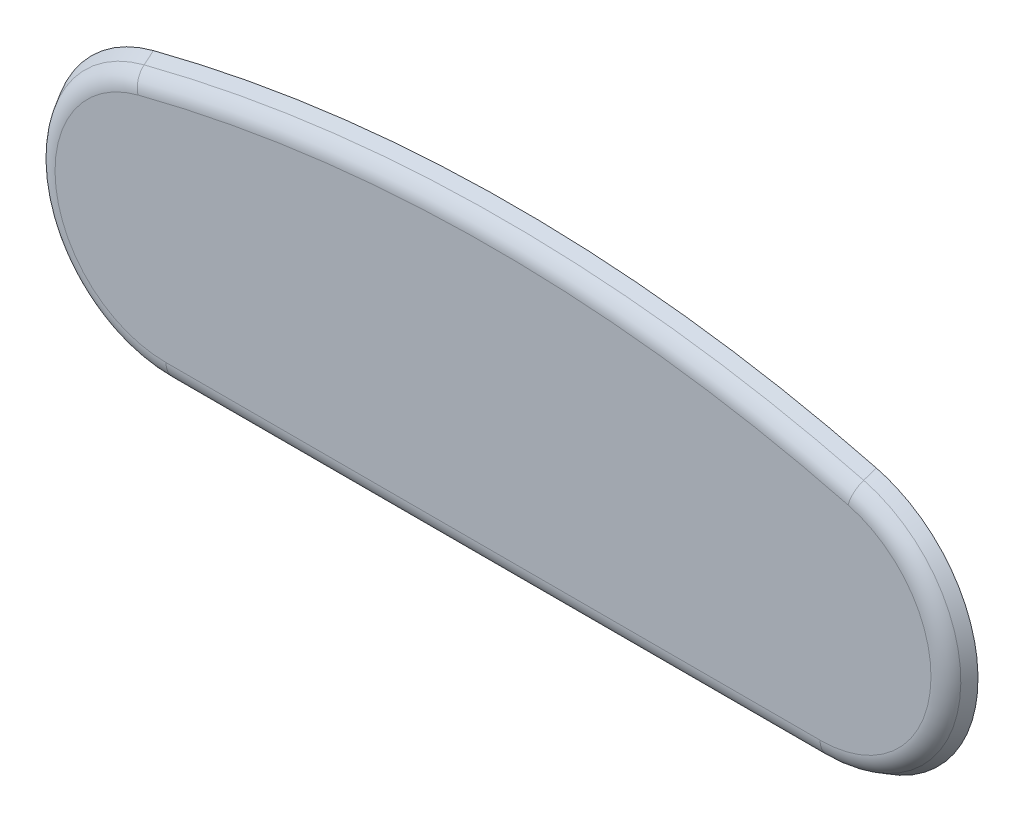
SolidWorks part; units mm, degrees
ref_plane "Ebene vorne" through (0, 0, 0) normal (0, 0, 1) x (1, 0, 0)
ref_plane "Ebene oben" through (0, 0, 0) normal (0, 1, 0) x (1, 0, 0)
ref_plane "Ebene rechts" through (0, 0, 0) normal (1, 0, 0) x (0, 0, -1)
sketch "Skizze1" plane through (0, 0, 0) normal (0, 0, 1) x (1, 0, 0)
  line L0 (-1719.6634, 0) -> (0, 0) construction
  line L1 (0, 0) -> (0, 745.1566) construction
  line L2 (-449.4874, -169.3223) -> (449.4874, -169.3223)
  arc A0 (492.3467, 163.9422) -> (449.4874, -169.3223) centre (450, 0) cw
  arc A1 (492.3467, 163.9422) -> (-492.3467, 163.9422) centre (0, -1742.1443) ccw
  arc A2 (-492.3467, 163.9422) -> (-449.4874, -169.3223) centre (-450, 0) ccw
  point P10 (0, -169.3223)
  dimension "D1" = 450
extrude "Linear austragen1" add sketch "Skizze1" against normal blind 30 draft 30
fillet "Verrundung1" radius 30 4 edges at (0, 226.5027, 0)
equation "\"LÄNGE\"=0"
equation "\"BREITE\"=0"
equation "\"HÖHE\"=0"
equation "\"DURCHMESSER\"=0"
equation "\"Stückzahl\"= 1"
